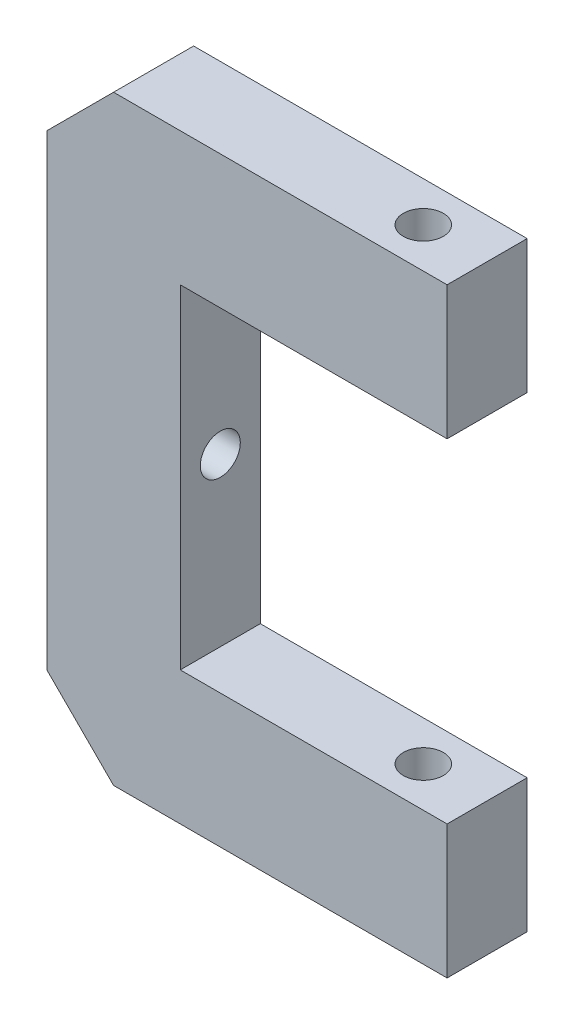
SolidWorks part; units mm, degrees
ref_plane "Front Plane" through (0, 0, 0) normal (0, 0, 1) x (1, 0, 0)
ref_plane "Top Plane" through (0, 0, 0) normal (0, 1, 0) x (1, 0, 0)
ref_plane "Right Plane" through (0, 0, 0) normal (1, 0, 0) x (0, 0, -1)
sketch "Sketch1" plane through (0, 0, 0) normal (0, 0, 1) x (1, 0, 0)
  line L0 (0, 0) -> (30, 0)
  line L1 (30, 0) -> (30, 10)
  line L2 (30, 10) -> (10, 10)
  line L3 (10, 10) -> (10, 35)
  line L4 (10, 35) -> (30, 35)
  line L5 (30, 35) -> (30, 45)
  line L6 (30, 45) -> (0, 45)
  line L7 (0, 45) -> (0, 0)
  dimension "D1" = 10
  dimension "D2" = 10
  dimension "D3" = 25
  dimension "D4" = 30
  dimension "D5" = 10
  dimension "D6" = 30
extrude "Extrude1" add sketch "Sketch1" along normal blind 6
sketch "Sketch2" plane through (0, 45, 0) normal (0, 1, 0) x (1, 0, 0)
  line L0 (30, -3) -> (0, -3) construction
  line L1 (30, -6) -> (30, 0) construction
  line L2 (0, -6) -> (0, 0) construction
  circle A0 centre (25.217, -3) radius 1.5
  dimension "D1" = 3
extrude "Extrude2" cut sketch "Sketch2" against normal through all
sketch "Sketch5" plane through (0, 0, 0) normal (-1, 0, 0) x (0, 0, 1)
  line L0 (3, 45) -> (3, 0) construction
  line L1 (6, 45) -> (0, 45) construction
  line L2 (6, 0) -> (0, 0) construction
  circle A0 centre (3, 22.5) radius 1.5
  dimension "D1" = 3
extrude "Extrude3" cut sketch "Sketch5" against normal through all
chamfer "Chamfer1" distance 5 angle 45 2 edges at (0, 0, 3) (0, 45, 3)
